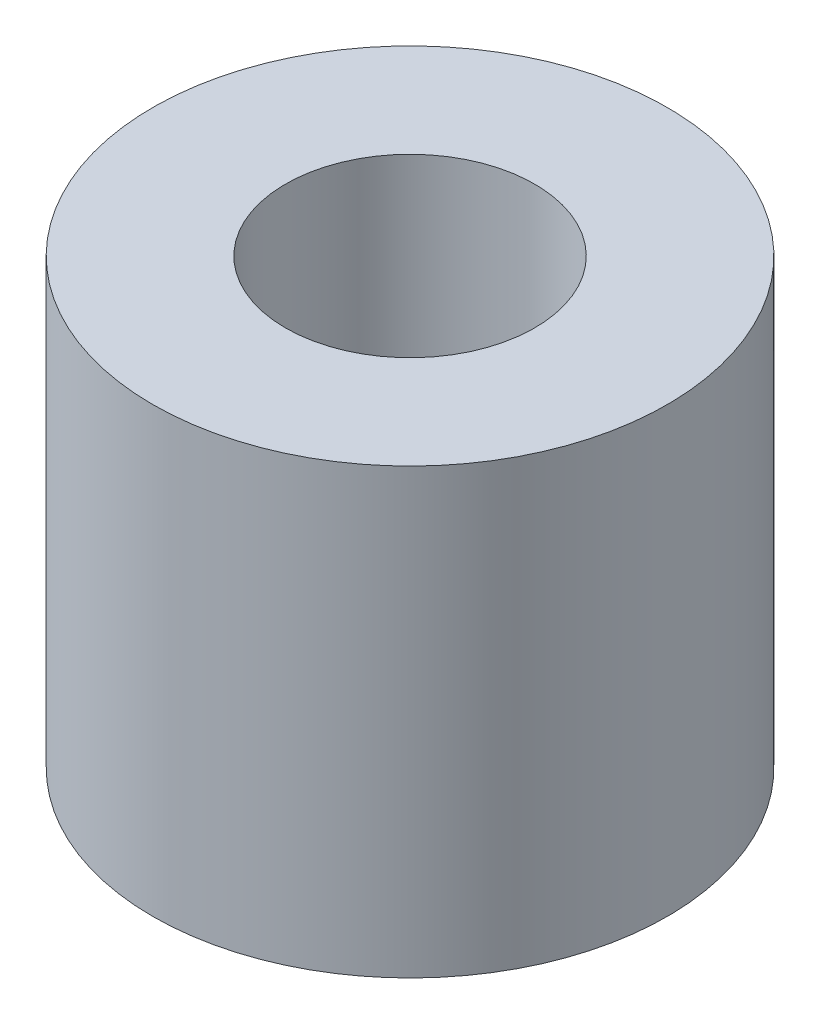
SolidWorks part; units mm, degrees
ref_plane "Front Plane" through (0, 0, 0) normal (0, 0, 1) x (1, 0, 0)
ref_plane "Top Plane" through (0, 0, 0) normal (0, 1, 0) x (1, 0, 0)
ref_plane "Right Plane" through (0, 0, 0) normal (1, 0, 0) x (0, 0, -1)
sketch "Sketch1" plane through (0, 0, 0) normal (0, 1, 0) x (1, 0, 0)
  circle A0 centre (0, 0) radius 1.1
  circle A1 centre (0, 0) radius 2.2712
extrude "Boss-Extrude1" add sketch "Sketch1" along normal blind 3.9135
